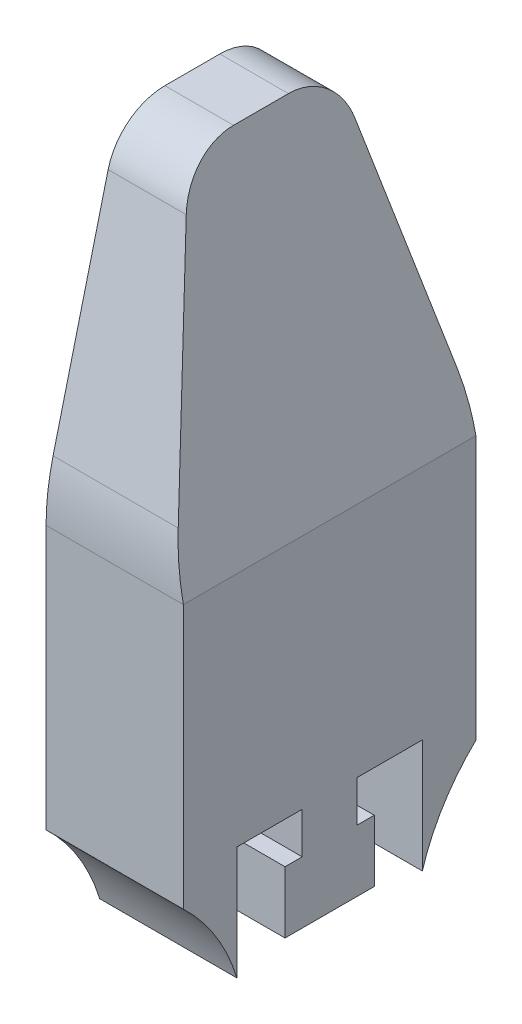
SolidWorks part; units mm, degrees
ref_plane "Front Plane" through (0, 0, 0) normal (0, 0, 1) x (1, 0, 0)
ref_plane "Top Plane" through (0, 0, 0) normal (0, 1, 0) x (1, 0, 0)
ref_plane "Right Plane" through (0, 0, 0) normal (1, 0, 0) x (0, 0, -1)
sketch "Sketch1" plane through (0, 0, 0) normal (1, 0, 0) x (0, 0, -1)
  line L1 (-21.3118, -34.0989) -> (-21.3118, 4.327)
  line L2 (-4, 51.1483) -> (4, 51.1483)
  line L3 (21.3118, -34.0989) -> (21.3118, 4.327)
  line L4 (0, -42.6236) -> (0, -37.063)
  line L5 (20.2937, 12.5971) -> (12.2702, 44.6912)
  line L6 (-20.2937, 12.5971) -> (-12.2702, 44.6912)
  line L7 (4, -30.1483) -> (13.5, -30.1483)
  line L8 (-6.5, -45.1483) -> (6.5, -45.1483)
  line L9 (-6.5, -45.1483) -> (-6.5, -36.1483)
  line L10 (-6.5, -36.1483) -> (-4, -36.1483)
  line L11 (6.5, -45.1483) -> (6.5, -36.1483)
  line L13 (-4, -36.1483) -> (-4, -30.1483)
  line L15 (4, -36.1483) -> (4, -30.1483)
  line L17 (-13.5, -46.6884) -> (-13.5, -30.1483)
  line L18 (-13.5, -30.1483) -> (-4, -30.1483)
  line L19 (13.5, -46.6884) -> (13.5, -30.1483)
  line L20 (4, -36.1483) -> (6.5, -36.1483)
  arc A0 (21.3118, -34.0989) -> (13.5, -46.6884) centre (41.4109, -55.2887) ccw
  arc A1 (-21.3118, -34.0989) -> (-13.5, -46.6884) centre (-41.4109, -55.2887) cw
  arc A2 (-20.2937, 12.5971) -> (-21.3118, 4.327) centre (12.7871, 4.327) ccw
  arc A3 (20.2937, 12.5971) -> (21.3118, 4.327) centre (-12.7871, 4.327) cw
  arc A4 (-12.2702, 44.6912) -> (-4, 51.1483) centre (-4, 42.6236) cw
  arc A5 (12.2702, 44.6912) -> (4, 51.1483) centre (4, 42.6236) ccw
  dimension "D1" = 13
  dimension "D2" = 6.5
  dimension "D4" = 9
  dimension "D5" = 8
  dimension "D6" = 6
  dimension "D8" = 27
  dimension "D9" = 13.5
extrude "Boss-Extrude1" add sketch "Sketch1" along normal blind 20 contours L1 A2 L6 A4 L2 A5 L5 A3 L3 A0 L19 L7 L15 L20 L11 L8 L9 L10 L13 L18 L17 A1
sketch "Sketch2" plane through (0, 0, 0) normal (0, 0, 1) x (1, 0, 0)
  line L0 (10, 51.1483) -> (20, 4.327)
  line L1 (20, 51.1483) -> (0, 51.1483) construction
  line L2 (20, 4.327) -> (20, 51.1483)
  line L3 (20, 51.1483) -> (10, 51.1483)
extrude "Cut-Extrude1" cut sketch "Sketch2" against normal through all both and the other way through all
